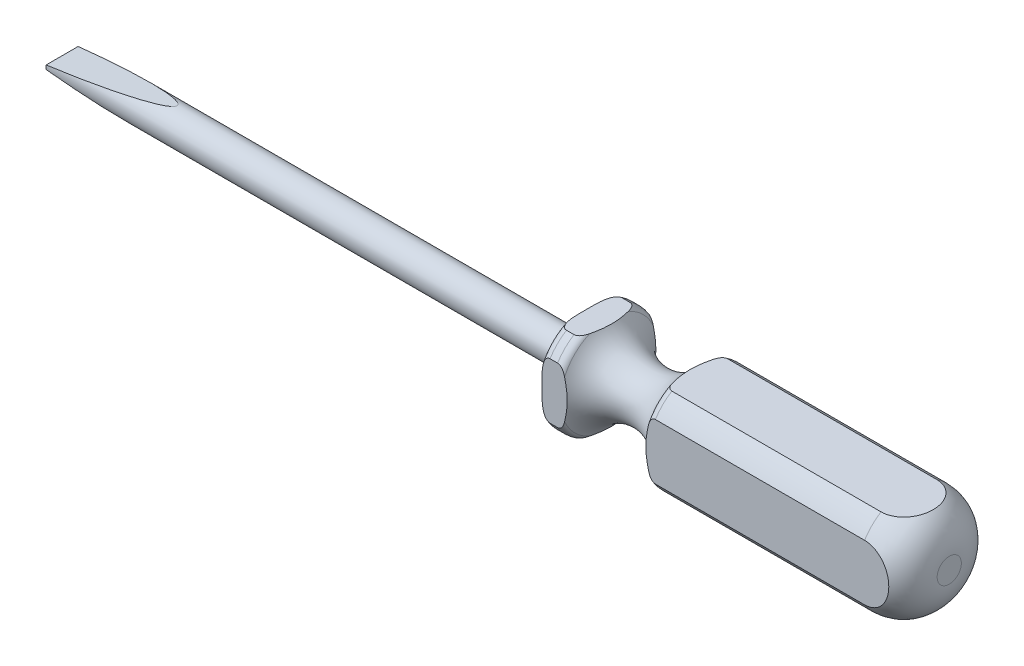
SolidWorks part; units mm, degrees
ref_plane "Front" through (0, 0, 0) normal (0, 0, 1) x (1, 0, 0)
ref_plane "Top" through (0, 0, 0) normal (0, 1, 0) x (1, 0, 0)
ref_plane "Right" through (0, 0, 0) normal (1, 0, 0) x (0, 0, -1)
sketch "Sketch1" plane through (0, 0, 0) normal (0, 0, 1) x (1, 0, 0)
  line L0 (0, 0) -> (-153.1047, 0) construction
  line L1 (0, 0) -> (0, 1.905)
  line L2 (-6.35, 8.255) -> (-39.291, 8.255)
  line L3 (-57.15, 6.985) -> (-57.15, 2.54)
  line L4 (-57.15, 2.54) -> (-139.7, 2.54)
  line L5 (-139.7, 2.54) -> (-139.7, 0)
  line L6 (-139.7, 0) -> (0, 0)
  line L7 (-54.689, 8.255) -> (-55.88, 8.255)
  arc A0 (-53.5891, 7.62) -> (-40.3909, 7.62) centre (-46.99, 11.43) ccw
  arc A1 (-55.88, 8.255) -> (-57.15, 6.985) centre (-55.88, 6.985) ccw
  arc A2 (-54.689, 8.255) -> (-53.5891, 7.62) centre (-54.689, 6.985) cw
  arc A3 (-39.291, 8.255) -> (-40.3909, 7.62) centre (-39.291, 6.985) ccw
  arc A4 (0, 1.905) -> (-6.35, 8.255) centre (-6.35, 1.905) ccw
  dimension "D3" = 7.62
  dimension "D8" = 1.27
  dimension "D9" = 6.35
  dimension "D1" = 139.7
  dimension "D2" = 57.15
  dimension "D4" = 11.43
  dimension "D5" = 46.99
  dimension "D6" = 8.255
  dimension "D7" = 2.54
revolve "Revolve1" add sketch "Sketch1" angle 360 about L0
sketch "Sketch2" plane through (0, 0, 0) normal (0, 0, 1) x (1, 0, 0)
  line L0 (0, 0) -> (-145.218, 0) construction
  line L1 (-121.5992, 2.54) -> (-139.7, 0.3175)
  line L2 (-57.15, 2.54) -> (-139.7, 2.54) construction
  line L3 (-139.7, 2.54) -> (-139.7, -2.54) construction
  line L4 (-121.5992, -2.54) -> (-139.7, -0.3175)
  line L5 (-139.7, 0.3175) -> (-139.7, -0.3175)
  point P11 (-139.7, 0)
  dimension "D1" = 0.635
  dimension "D2" = 7
extrude "Cut-Extrude1" cut sketch "Sketch2" against normal through all and the other way through all
sketch "Sketch3" plane through (0, 0, 0) normal (1, 0, 0) x (0, 0, -1)
  line L0 (0, 0) -> (11.0054, 0) construction
  line L1 (-6.35, -10.16) -> (-6.35, -6.985)
  line L2 (-6.35, 10.16) -> (6.35, 10.16)
  line L3 (-6.35, 10.16) -> (-6.35, 6.985)
  line L4 (-6.35, 6.985) -> (6.35, 6.985)
  line L5 (6.35, 10.16) -> (6.35, 6.985)
  line L6 (-6.35, -10.16) -> (6.35, -10.16)
  line L7 (6.35, -10.16) -> (6.35, -6.985)
  line L8 (-6.35, -6.985) -> (6.35, -6.985)
  line L9 (0, 0) -> (0, 9.5234) construction
  line L10 (-6.985, 6.35) -> (-6.985, -6.35)
  line L11 (6.985, 6.35) -> (10.16, 6.35)
  line L12 (6.985, 6.35) -> (6.985, -6.35)
  line L13 (6.985, -6.35) -> (10.16, -6.35)
  line L14 (10.16, 6.35) -> (10.16, -6.35)
  line L15 (-6.985, 6.35) -> (-10.16, 6.35)
  line L16 (-10.16, 6.35) -> (-10.16, -6.35)
  line L17 (-6.985, -6.35) -> (-10.16, -6.35)
  dimension "D1" = 6.985
  dimension "D2" = 6.985
  dimension "D3" = 12.7
  dimension "D4" = 10.16
extrude "Cut-Extrude2" cut sketch "Sketch3" against normal up to surface (57.15 mm away)
